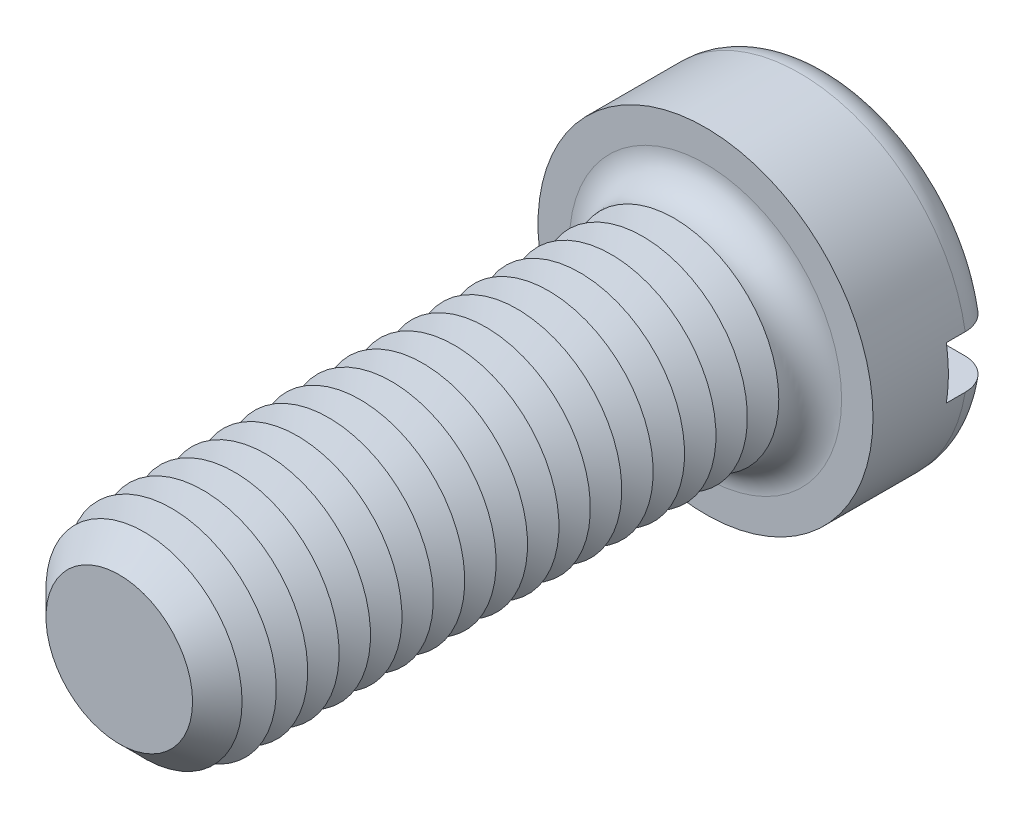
SolidWorks part; units mm, degrees
ref_plane "Front Plane" through (0, 0, 0) normal (0, 0, 1) x (1, 0, 0)
ref_plane "Top Plane" through (0, 0, 0) normal (0, 1, 0) x (1, 0, 0)
ref_plane "Right Plane" through (0, 0, 0) normal (1, 0, 0) x (0, 0, -1)
sketch "Sketch3" plane through (0, 0, 0) normal (0, 0, 1) x (1, 0, 0)
  circle A0 centre (0, 0) radius 8
  dimension "D1" = 16
extrude "Boss-Extrude2" add sketch "Sketch3" against normal blind 6
sketch "Sketch4" plane through (0, 0, 0) normal (0, 0, 1) x (1, 0, 0)
  circle A0 centre (0, 0) radius 5
  dimension "D1" = 10
extrude "Boss-Extrude3" add sketch "Sketch4" along normal blind 28
fillet "Fillet1" radius 1.5 2 edges at (8, 0, -6) (5, 0, 0)
chamfer "Chamfer1" distance 1.5 angle 45 1 edges at (5, 0, 28)
sketch "Sketch5" plane through (0, 0, 0) normal (1, 0, 0) x (0, 0, -1)
  line L0 (1.6944, 0) -> (-7.6738, 0) construction
sketch "Sketch6" plane through (0, 0, 0) normal (1, 0, 0) x (0, 0, -1)
  line L0 (-1.5, 5) -> (-2.25, 3.701)
  line L1 (-2.25, 3.701) -> (-3, 5)
  line L2 (-1.5, 5) -> (-26.5, 5) construction
  line L3 (-3, 5) -> (-1.5, 5)
  dimension "D1" = 1.5
revolve "Cut-Revolve1" cut sketch "Sketch6" angle 360 about L0
pattern_linear "LPattern1" count 17 spacing 1.5 along (0, 0, 1) of "Cut-Revolve1"
sketch "Sketch8" plane through (0, 0, -6) normal (0, 0, -1) x (-1, 0, 0)
  line L1 (8, -1.25) -> (-8, -1.25)
  line L2 (8, -1.25) -> (8, 1.25)
  line L3 (8, 1.25) -> (-8, 1.25)
  line L4 (-8, -1.25) -> (-8, 1.25)
  line L5 (8, -1.25) -> (-8, 1.25) construction
  line L6 (8, 1.25) -> (-8, -1.25) construction
  point P0 (0, 0)
  dimension "D1" = 16
  dimension "D2" = 2.5
extrude "Cut-Extrude1" cut sketch "Sketch8" against normal blind 2.4
